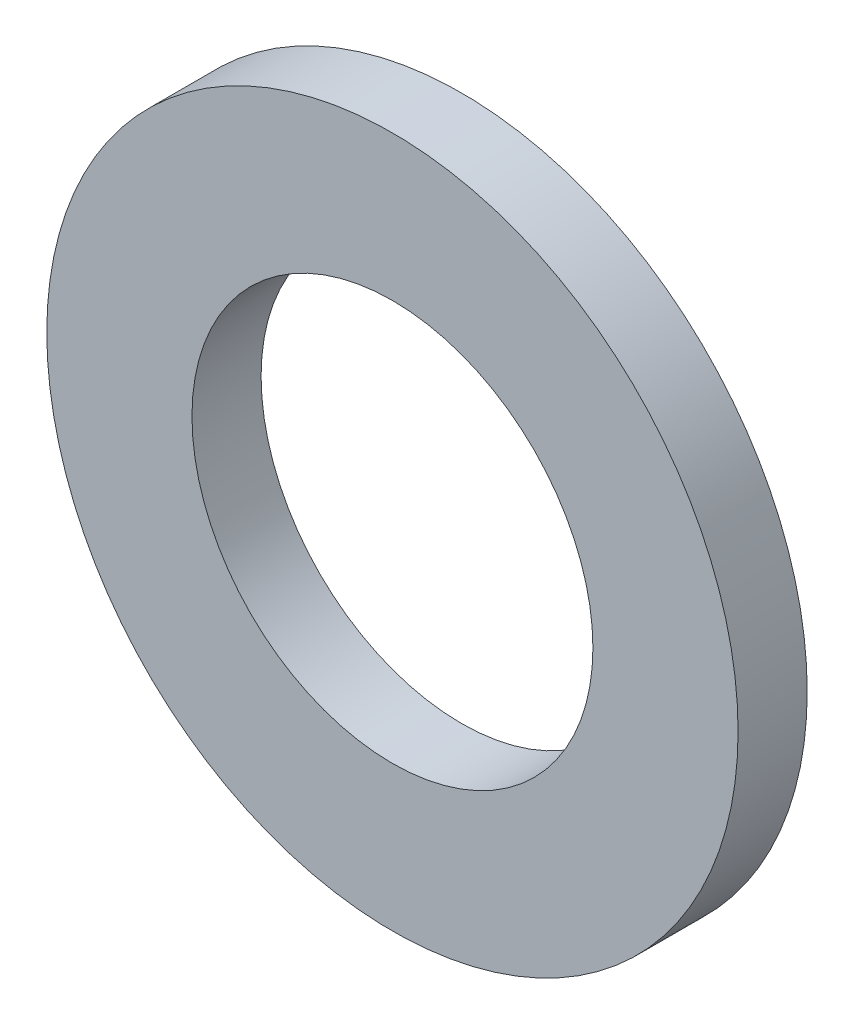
SolidWorks part; units mm, degrees
ref_plane "Plan de face" through (0, 0, 0) normal (0, 0, 1) x (1, 0, 0)
ref_plane "Plan de dessus" through (0, 0, 0) normal (0, 1, 0) x (1, 0, 0)
ref_plane "Plan de droite" through (0, 0, 0) normal (1, 0, 0) x (0, 0, -1)
sketch "Esquisse1" plane through (0, 0, 0) normal (0, 0, 1) x (1, 0, 0)
  circle A0 centre (0, 0) radius 7.25
  circle A1 centre (0, 0) radius 12.5
  dimension "D1" = 14.5
  dimension "D2" = 25
extrude "Extrusion1" add sketch "Esquisse1" along normal blind 2.5
